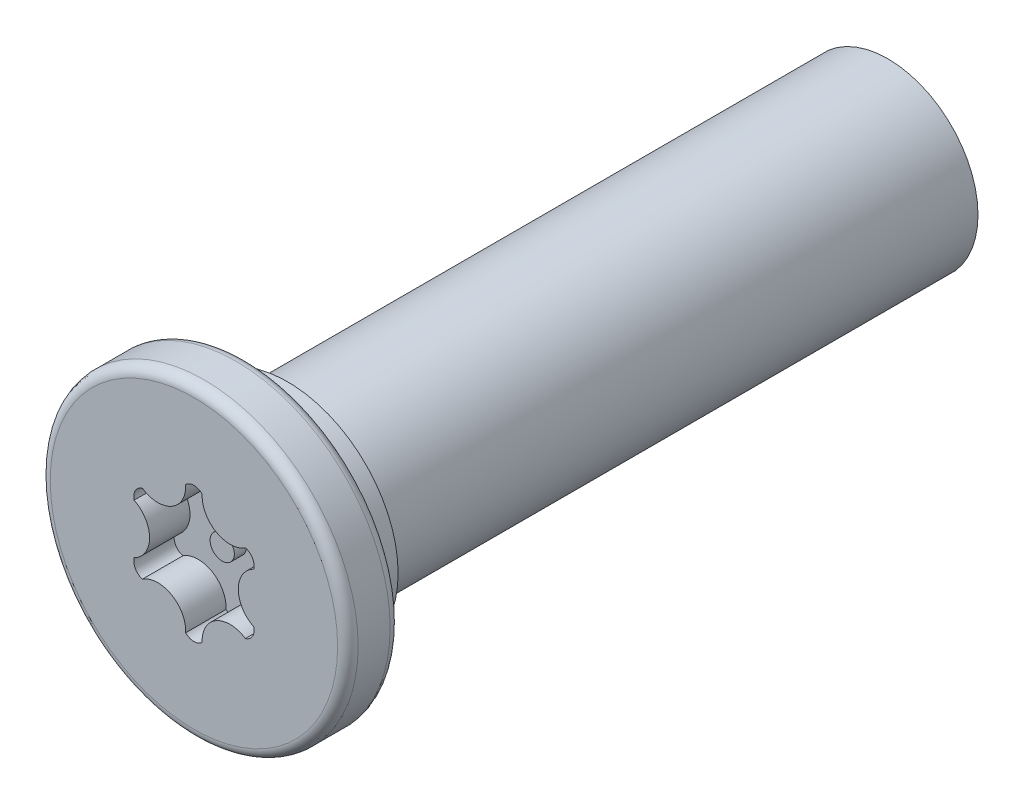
SolidWorks part; units mm, degrees
ref_plane "Front Plane" through (0, 0, 0) normal (0, 0, 1) x (1, 0, 0)
ref_plane "Top Plane" through (0, 0, 0) normal (0, 1, 0) x (1, 0, 0)
ref_plane "Right Plane" through (0, 0, 0) normal (1, 0, 0) x (0, 0, -1)
sketch "Sketch2" plane through (0, 0, 0) normal (1, 0, 0) x (0, 0, -1)
  line L1 (0, 0) -> (1.3, 0)
  line L2 (0, 0) -> (0, 3.81)
  line L3 (0, 3.81) -> (1.3, 3.81)
  line L4 (1.3, 0) -> (1.3, 3.81)
  line L5 (1.3, 0) -> (14, 0)
  line L6 (1.3, 0) -> (1.3, 2.23)
  line L7 (1.3, 2.23) -> (14, 2.23)
  line L8 (14, 0) -> (14, 2.23)
  dimension "D1" = 3.81
  dimension "D2" = 1.3
  dimension "D3" = 12.7
  dimension "D4" = 2.23
revolve "Revolve1" add sketch "Sketch2" angle 360 about L5
sketch "Sketch3" plane through (0, 0, 0) normal (0, 0, 1) x (1, 0, 0)
  line L0 (0, 1.3843) -> (0, 0)
  line L3 (1.1845, -1.0048) -> (2.4257, -1.0048)
  line L4 (0, 1.675) -> (0, 1.6727)
  line L5 (0, 1.675) -> (0, 1.6727)
  line L6 (0, 1.6727) -> (0, 1.675)
  line L8 (1.0407, 1.8026) -> (1.1012, 1.9073)
  line L9 (1.3857, 1.205) -> (2.5818, 1.205)
  line L10 (0, 0) -> (0.8375, 1.4506)
  line L11 (0, 0) -> (2.5818, 0)
  line L14 (2.5818, 0) -> (2.5818, 1.205)
  line L15 (1.3857, 1.205) -> (-0.1691, 1.205)
  circle A0 centre (0, 0) radius 1.675
  arc A7 (1.1845, -1.0048) -> (1.0345, -1.0748) centre (0.8546, -0.4934) cw
  arc A16 (-0.2051, 1.5894) -> (0.2051, 1.5894) centre (0, 1.3843) cw
  arc A18 (0.2051, 1.5894) -> (1.2739, 0.9723) centre (0.8938, 1.5482) ccw
  arc A19 (1.479, 0.6171) -> (1.479, -0.6171) centre (1.7877, 0) ccw
  arc A20 (1.2739, 0.9723) -> (1.479, 0.6171) centre (1.1988, 0.6922) cw
  arc A21 (1.2739, -0.9723) -> (0.2051, -1.5894) centre (0.8938, -1.5482) ccw
  arc A22 (1.479, -0.6171) -> (1.2739, -0.9723) centre (1.1988, -0.6922) cw
  arc A23 (-0.2051, -1.5894) -> (-1.2739, -0.9723) centre (-0.8938, -1.5482) ccw
  arc A24 (0.2051, -1.5894) -> (-0.2051, -1.5894) centre (0, -1.3843) cw
  arc A25 (-1.479, -0.6171) -> (-1.479, 0.6171) centre (-1.7877, 0) ccw
  arc A26 (-1.2739, -0.9723) -> (-1.479, -0.6171) centre (-1.1988, -0.6922) cw
  arc A27 (-1.2739, 0.9723) -> (-0.2051, 1.5894) centre (-0.8938, 1.5482) ccw
  arc A28 (-1.479, 0.6171) -> (-1.2739, 0.9723) centre (-1.1988, 0.6922) cw
  point P38 (0, 0)
  point P52 (0, 0)
  dimension "D1" = 3.35
  dimension "D4" = 1.205
  dimension "D2" = 6
  dimension "D5" = 60
extrude "Cut-Extrude3" cut sketch "Sketch3" against normal blind 1
fillet "Fillet12" radius 0.254 2 edges at (3.81, 0, 0) (3.81, 0, -1.3)
sketch "Sketch7" plane through (0, 0, -14) normal (0, 0, -1) x (-1, 0, 0)
  circle A0 centre (0, 0) radius 2.23
  dimension "D1" = 4.46
extrude "Cut-Extrude6" cut sketch "Sketch7" against normal blind 12.7
sketch "Sketch11" plane through (0, 0, -1.3) normal (0, 0, -1) x (-1, 0, 0)
  circle A0 centre (0, 0) radius 2.23
  circle A1 centre (0, 0) radius 2.738
extrude "Boss-Extrude1" add sketch "Sketch11" along normal blind 1.016
sketch "Sketch12" plane through (0, 0, -1.3) normal (0, 0, -1) x (-1, 0, 0)
  circle A0 centre (0, 0) radius 2.23
extrude "Boss-Extrude2" add sketch "Sketch12" along normal blind 12.7
sketch "Sketch14" plane through (0, 0, -1) normal (0, 0, 1) x (1, 0, 0)
  circle A0 centre (0, 0) radius 0.3
extrude "Boss-Extrude4" add sketch "Sketch14" along normal blind 0.3
sketch "Sketch15" plane through (0, 0, -14) normal (0, 0, -1) x (-1, 0, 0)
  circle A0 centre (0, 0) radius 2.23
extrude "Cut-Extrude7" cut sketch "Sketch15" against normal blind 12.7
sketch "Sketch16" plane through (0, 0, -1.3) normal (0, 0, -1) x (-1, 0, 0)
  circle A0 centre (0, 0) radius 2.23
extrude "Boss-Extrude5" add sketch "Sketch16" along normal blind 15.875
